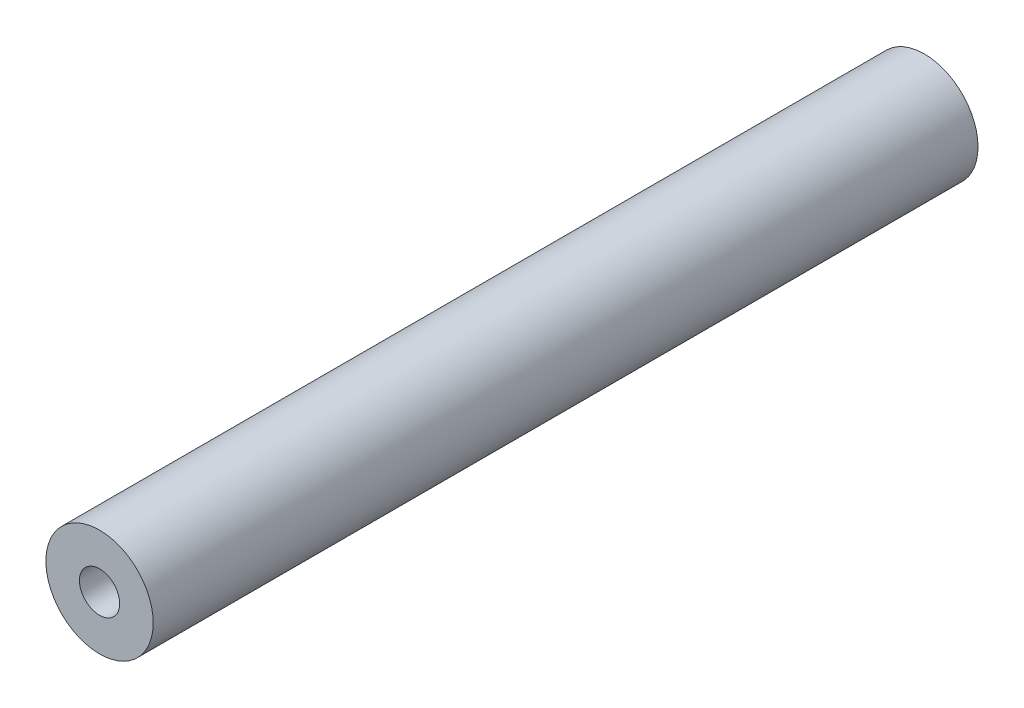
SolidWorks part; units mm, degrees
ref_plane "前视基准面" through (0, 0, 0) normal (0, 0, 1) x (1, 0, 0)
ref_plane "上视基准面" through (0, 0, 0) normal (0, 1, 0) x (1, 0, 0)
ref_plane "右视基准面" through (0, 0, 0) normal (1, 0, 0) x (0, 0, -1)
sketch "草图1" plane through (0, 0, 0) normal (0, 0, 1) x (1, 0, 0)
  circle A0 centre (0, 0) radius 8
extrude "凸台-拉伸1" add sketch "草图1" along normal blind 123
sketch "草图2" plane through (0, 0, 123) normal (0, 0, 1) x (1, 0, 0)
  circle A0 centre (0, 0) radius 3
extrude "切除-拉伸1" cut sketch "草图2" against normal blind 15
sketch "草图3" plane through (0, 0, 0) normal (0, 0, -1) x (-1, 0, 0)
  circle A0 centre (0, 0) radius 3
extrude "切除-拉伸2" cut sketch "草图3" against normal blind 15
